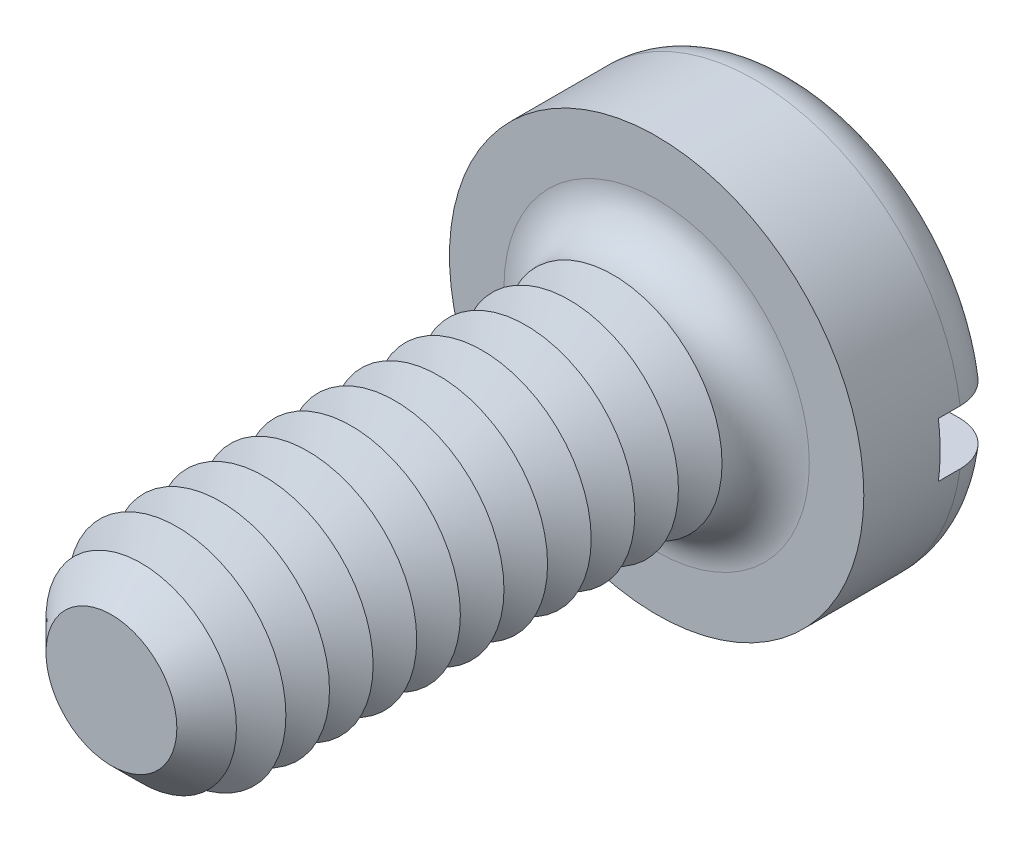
SolidWorks part; units mm, degrees
ref_plane "Front Plane" through (0, 0, 0) normal (0, 0, 1) x (1, 0, 0)
ref_plane "Top Plane" through (0, 0, 0) normal (0, 1, 0) x (1, 0, 0)
ref_plane "Right Plane" through (0, 0, 0) normal (1, 0, 0) x (0, 0, -1)
sketch "Sketch3" plane through (0, 0, 0) normal (0, 0, 1) x (1, 0, 0)
  circle A0 centre (0, 0) radius 1.9
  dimension "D1" = 3.8
extrude "Boss-Extrude2" add sketch "Sketch3" against normal blind 1.3
sketch "Sketch4" plane through (0, 0, 0) normal (0, 0, 1) x (1, 0, 0)
  circle A0 centre (0, 0) radius 1
  dimension "D1" = 2
extrude "Boss-Extrude3" add sketch "Sketch4" along normal blind 5
fillet "Fillet1" radius 0.4 2 edges at (1.9, 0, -1.3) (1, 0, 0)
chamfer "Chamfer1" distance 0.4 angle 45 1 edges at (1, 0, 5)
sketch "Sketch5" plane through (0, 0, 0) normal (1, 0, 0) x (0, 0, -1)
  line L0 (1.6944, 0) -> (-7.6738, 0) construction
sketch "Sketch6" plane through (0, 0, 0) normal (1, 0, 0) x (0, 0, -1)
  line L0 (-0.4, 1) -> (-0.6, 0.6536)
  line L1 (-0.6, 0.6536) -> (-0.8, 1)
  line L2 (-0.4, 1) -> (-4.6, 1) construction
  line L3 (-0.8, 1) -> (-0.4, 1)
  dimension "D1" = 0.4
revolve "Cut-Revolve1" cut sketch "Sketch6" angle 360 about L0
pattern_linear "LPattern1" count 11 spacing 0.4 along (0, 0, 1) of "Cut-Revolve1"
sketch "Sketch8" plane through (0, 0, -1.3) normal (0, 0, -1) x (-1, 0, 0)
  line L1 (1.9, -0.25) -> (-1.9, -0.25)
  line L2 (1.9, -0.25) -> (1.9, 0.25)
  line L3 (1.9, 0.25) -> (-1.9, 0.25)
  line L4 (-1.9, -0.25) -> (-1.9, 0.25)
  line L5 (1.9, -0.25) -> (-1.9, 0.25) construction
  line L6 (1.9, 0.25) -> (-1.9, -0.25) construction
  point P0 (0, 0)
  dimension "D1" = 3.8
  dimension "D2" = 0.5
extrude "Cut-Extrude1" cut sketch "Sketch8" against normal blind 0.6
